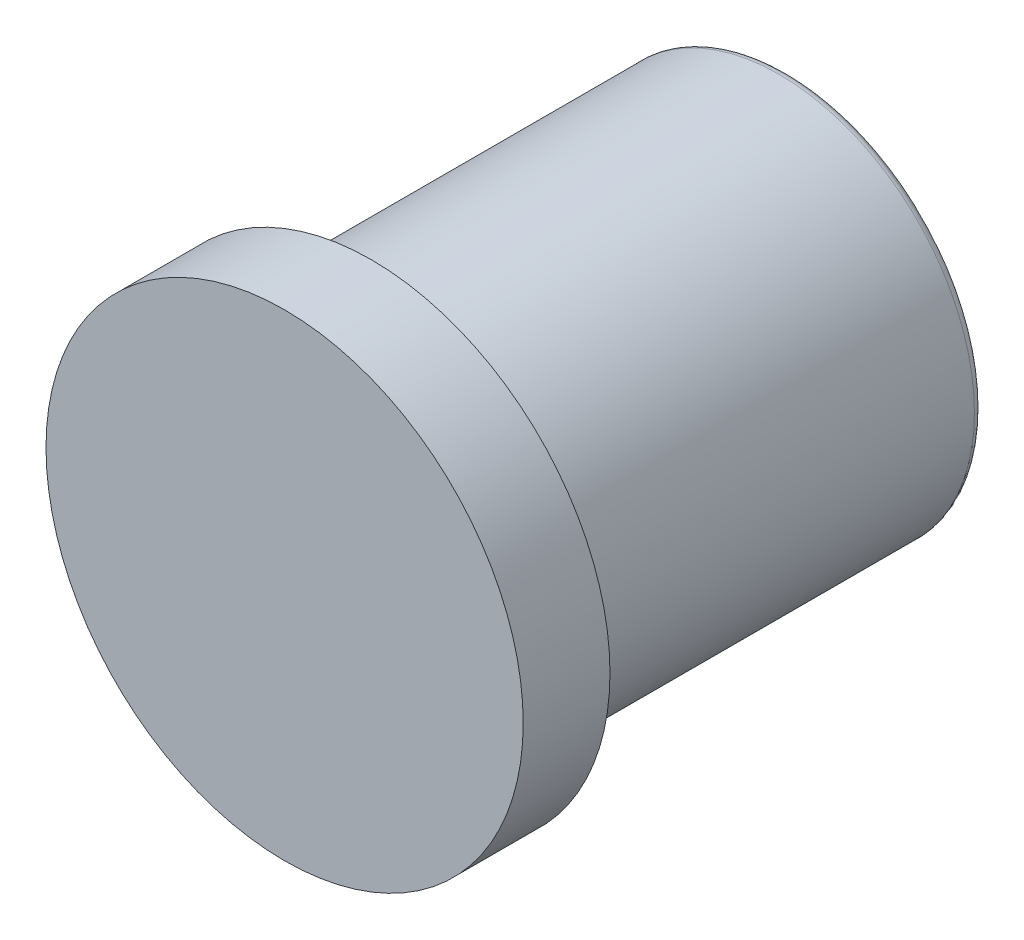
SolidWorks part; units mm, degrees
ref_plane "Front Plane" through (0, 0, 0) normal (0, 0, 1) x (1, 0, 0)
ref_plane "Top Plane" through (0, 0, 0) normal (0, 1, 0) x (1, 0, 0)
ref_plane "Right Plane" through (0, 0, 0) normal (1, 0, 0) x (0, 0, -1)
sketch "Sketch1" plane through (0, 0, 0) normal (1, 0, 0) x (0, 0, -1)
  line L0 (0, 0) -> (58, 0) construction
  line L1 (58, 0) -> (58, 21.5)
  line L2 (57, 22.5) -> (10, 22.5)
  line L3 (10, 22.5) -> (10, 27.5)
  line L4 (10, 27.5) -> (0, 27.5)
  line L5 (0, 27.5) -> (0, 0)
  line L6 (0, 0) -> (58, 0)
  arc A0 (58, 21.5) -> (57, 22.5) centre (57, 21.5) ccw
  dimension "D5" = 1
  dimension "D1" = 45
  dimension "D2" = 55
  dimension "D3" = 10
  dimension "D4" = 48
revolve "Revolve1" add sketch "Sketch1" angle 360 about L0
hole_wizard "M8 Tapped Hole1" positions "Sketch4" profile "Sketch3" tap size "M8" standard "AS"
sketch "Sketch4" plane through (0, 0, -58) normal (0, 0, -1) x (-1, 0, 0)
  point P0 (0, 0)
sketch "Sketch3" plane through (0, 0, -58) normal (1, 0, 0) x (0, 1, 0)
  line L0 (0, 0) -> (0, 13.7929)
  line L1 (0, 13.7929) -> (3.4, 11.75)
  line L2 (3.4, 11.75) -> (3.4, 0.625)
  line L3 (3.4, 0.625) -> (4.025, 0)
  line L5 (4.025, 0) -> (0, 0)
  line L6 (-3.4, 0.625) -> (-4.025, 0) construction
  line L10 (0, 13.7929) -> (-3.4, 11.75) construction
  line L11 (0, -6.35) -> (0, 107.95) construction
  dimension "Tap Drill Dia." = 6.8
  dimension "Tap Drill Depth" = 11.75
  dimension "Near C'Sink Dia." = 8.05
  dimension "Near C'Sink Angle" = 90
  dimension "Drill Angle" = 118
